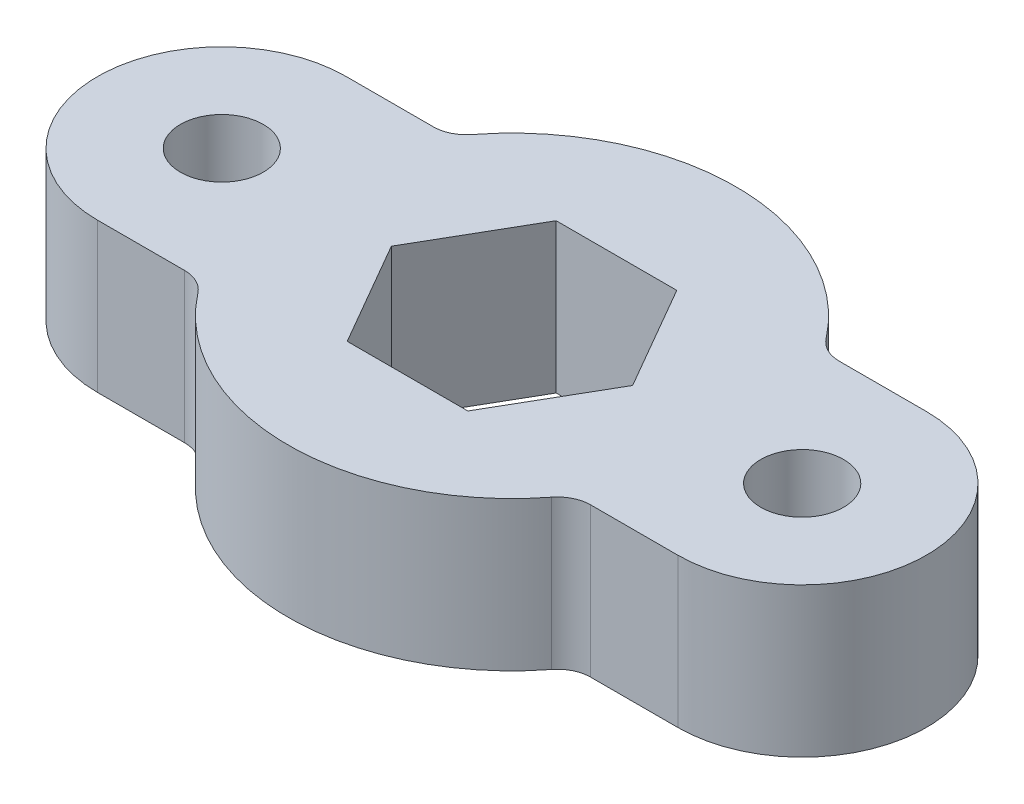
SolidWorks part; units mm, degrees
ref_plane "Front Plane" through (0, 0, 0) normal (0, 0, 1) x (1, 0, 0)
ref_plane "Top Plane" through (0, 0, 0) normal (0, 1, 0) x (1, 0, 0)
ref_plane "Right Plane" through (0, 0, 0) normal (1, 0, 0) x (0, 0, -1)
sketch "Sketch1" plane through (0, 0, 0) normal (0, 1, 0) x (1, 0, 0)
  line L0 (0, 0) -> (85.4219, 0) construction
  line L1 (3.6373, 6.3) -> (-3.6373, 6.3)
  line L2 (-3.6373, 6.3) -> (-7.2746, 0)
  line L3 (-7.2746, 0) -> (-3.6373, -6.3)
  line L4 (-3.6373, -6.3) -> (3.6373, -6.3)
  line L5 (3.6373, -6.3) -> (7.2746, 0)
  line L6 (7.2746, 0) -> (3.6373, 6.3)
  line L7 (0, 0) -> (0, 78.1807) construction
  line L8 (-17.5, 0) -> (17.5, 0) construction
  line L9 (-17.5, 7.5) -> (-11.225, 7.5)
  line L10 (-17.5, -7.5) -> (-11.225, -7.5)
  line L11 (17.5, 7.5) -> (11.225, 7.5)
  line L12 (17.5, -7.5) -> (11.225, -7.5)
  circle A0 centre (0, 0) radius 6.3 construction
  arc A1 (-11.225, -7.5) -> (11.225, -7.5) centre (0, 0) ccw
  circle A2 centre (-17.5, 0) radius 2.5
  circle A3 centre (17.5, 0) radius 2.5
  arc A4 (-17.5, 7.5) -> (-17.5, -7.5) centre (-17.5, 0) ccw
  arc A5 (17.5, -7.5) -> (17.5, 7.5) centre (17.5, 0) ccw
  circle A6 centre (-17.5, 0) radius 7.5 construction
  circle A7 centre (17.5, 0) radius 7.5 construction
  arc A8 (11.225, 7.5) -> (-11.225, 7.5) centre (0, 0) ccw
  point P20 (0, 0)
  dimension "D2" = 27
  dimension "D4" = 5
  dimension "D1" = 12.6
  dimension "D5" = 35
  dimension "D6" = 5
extrude "Boss-Extrude1" add sketch "Sketch1" along normal blind 9
fillet "Fillet1" radius 2 4 edges at (-11.225, 4.5, -7.5) (11.225, 4.5, -7.5) (11.225, 4.5, 7.5) (-11.225, 4.5, 7.5)
